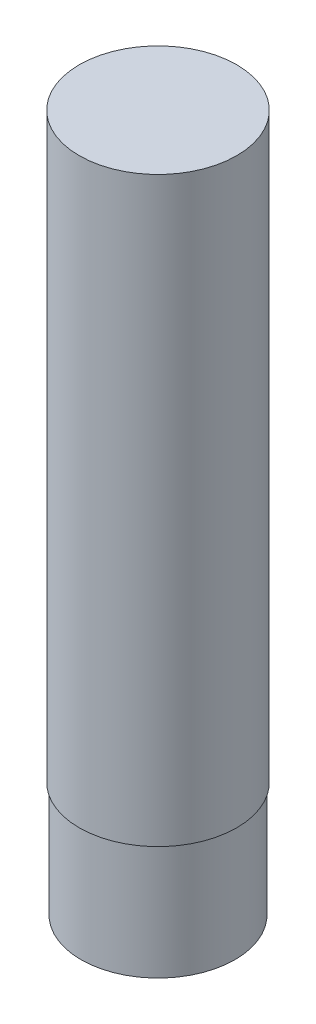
SolidWorks part; units mm, degrees
ref_plane "Front Plane" through (0, 0, 0) normal (0, 0, 1) x (1, 0, 0)
ref_plane "Top Plane" through (0, 0, 0) normal (0, 1, 0) x (1, 0, 0)
ref_plane "Right Plane" through (0, 0, 0) normal (1, 0, 0) x (0, 0, -1)
sketch "Sketch1" plane through (0, 0, 0) normal (0, 1, 0) x (1, 0, 0)
  circle A0 centre (0, 0) radius 29.21
  dimension "D1" = 58.42
extrude "Boss-Extrude1" add sketch "Sketch1" along normal blind 215.9
sketch "Sketch2" plane through (0, 0, 0) normal (0, -1, 0) x (1, 0, 0)
  circle A0 centre (0, 0) radius 28.575
extrude "Boss-Extrude2" add sketch "Sketch2" along normal blind 42.672
